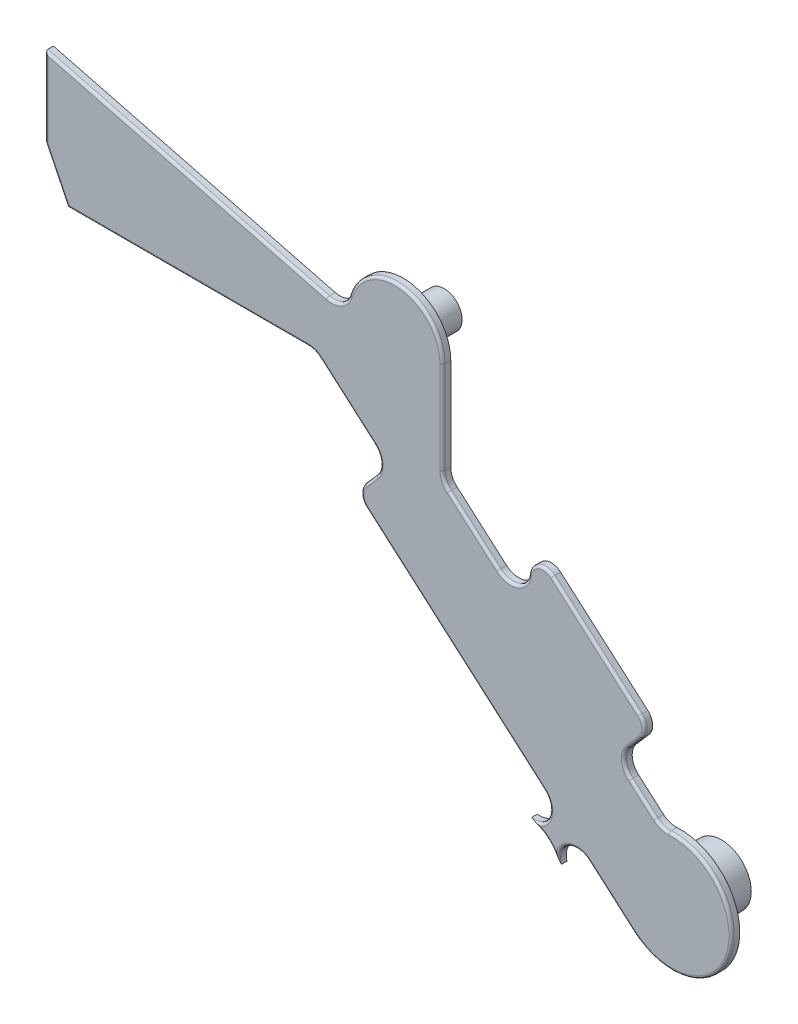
SolidWorks part; units mm, degrees
ref_plane "Front" through (0, 0, 0) normal (0, 0, 1) x (1, 0, 0)
ref_plane "Top" through (0, 0, 0) normal (0, 1, 0) x (1, 0, 0)
ref_plane "Right" through (0, 0, 0) normal (1, 0, 0) x (0, 0, -1)
sketch "Sketch1" plane through (0, 0, 0) normal (0, 0, 1) x (1, 0, 0)
  line L0 (21.628, -32.9834) -> (68.2018, -32.9834) construction
  line L1 (70.565, -33.8706) -> (81.0526, -43.0369) construction
  line L2 (81.3932, -48.1039) -> (79.2284, -50.5807) construction
  line L3 (79.4901, -54.4737) -> (113.9141, -84.5608) construction
  line L5 (135.4997, -78.6592) -> (130.6545, -74.4244) construction
  line L6 (130.3138, -69.3574) -> (132.7081, -66.618) construction
  line L7 (132.4464, -62.7249) -> (115.5735, -47.9777) construction
  line L8 (105.0817, -52.0734) -> (95.512, -43.7094) construction
  line L9 (94.2842, -41.0055) -> (94.2842, -23.1128) construction
  line L10 (71.896, -22.8886) -> (17.3176, -8.8418) construction
  line L11 (21.628, -32.9834) -> (68.2018, -32.9834)
  line L12 (70.565, -33.8706) -> (81.0526, -43.0369)
  line L13 (81.3932, -48.1039) -> (79.2284, -50.5807)
  line L14 (79.4901, -54.4737) -> (113.9141, -84.5608)
  line L15 (122.61, -92.1612) -> (131.2013, -99.6701)
  line L16 (135.4997, -78.6592) -> (130.6545, -74.4244)
  line L17 (130.3138, -69.3574) -> (132.7081, -66.618)
  line L18 (132.4464, -62.7249) -> (115.5735, -47.9777)
  line L19 (105.0817, -52.0734) -> (95.512, -43.7094)
  line L20 (94.2842, -41.0055) -> (94.2842, -23.1128)
  line L21 (71.896, -22.8886) -> (17.3176, -8.8418)
  line L22 (17.3176, -24.1697) -> (17.3176, -8.8418) construction
  line L23 (17.3176, -24.1697) -> (17.3176, -8.8418)
  line L24 (21.628, -32.9834) -> (17.3176, -24.1697)
  arc A0 (70.565, -33.8706) -> (68.2018, -32.9834) centre (68.2018, -36.5744) ccw construction
  arc A1 (81.3932, -48.1039) -> (81.0526, -43.0369) centre (78.6894, -45.7407) ccw construction
  arc A2 (79.2284, -50.5807) -> (79.4901, -54.4737) centre (81.3058, -52.3964) ccw construction
  arc A6 (131.2013, -99.6701) -> (138.0779, -79.54) centre (138.7662, -91.0147) ccw construction
  arc A7 (135.4997, -78.6592) -> (138.0779, -79.54) centre (137.8629, -75.9554) ccw construction
  arc A8 (130.3138, -69.3574) -> (130.6545, -74.4244) centre (133.0176, -71.7206) ccw construction
  arc A9 (132.7081, -66.618) -> (132.4464, -62.7249) centre (130.6307, -64.8023) ccw construction
  arc A10 (115.5735, -47.9777) -> (111.0149, -49.7573) centre (113.7578, -50.0551) ccw construction
  arc A11 (105.0817, -52.0734) -> (111.0149, -49.7573) centre (107.4449, -49.3696) ccw construction
  arc A12 (94.2842, -41.0055) -> (95.512, -43.7094) centre (97.8752, -41.0055) ccw construction
  arc A13 (94.2842, -23.1128) -> (76.2289, -20.4482) centre (85.0599, -23.1128) ccw construction
  arc A14 (71.896, -22.8886) -> (76.2289, -20.4482) centre (72.791, -19.4109) ccw construction
  arc A15 (70.565, -33.8706) -> (68.2018, -32.9834) centre (68.2018, -36.5744) ccw
  arc A16 (81.3932, -48.1039) -> (81.0526, -43.0369) centre (78.6894, -45.7407) ccw
  arc A17 (79.2284, -50.5807) -> (79.4901, -54.4737) centre (81.3058, -52.3964) ccw
  arc A18 (116.7891, -95.8343) -> (111.0532, -90.821) centre (110.0887, -97.7125) ccw
  arc A19 (111.0532, -90.821) -> (116.7891, -95.8343) centre (110.0887, -97.7125) ccw construction
  arc A20 (111.0532, -90.821) -> (113.9141, -84.5608) centre (111.5509, -87.2646) ccw construction
  arc A21 (131.2013, -99.6701) -> (138.0779, -79.54) centre (138.7662, -91.0147) ccw
  arc A22 (135.4997, -78.6592) -> (138.0779, -79.54) centre (137.8629, -75.9554) ccw
  arc A23 (130.3138, -69.3574) -> (130.6545, -74.4244) centre (133.0176, -71.7206) ccw
  arc A24 (132.7081, -66.618) -> (132.4464, -62.7249) centre (130.6307, -64.8023) ccw
  arc A25 (115.5735, -47.9777) -> (111.0149, -49.7573) centre (113.7578, -50.0551) ccw
  arc A26 (105.0817, -52.0734) -> (111.0149, -49.7573) centre (107.4449, -49.3696) ccw
  arc A27 (94.2842, -41.0055) -> (95.512, -43.7094) centre (97.8752, -41.0055) ccw
  arc A28 (94.2842, -23.1128) -> (76.2289, -20.4482) centre (85.0599, -23.1128) ccw
  arc A29 (71.896, -22.8886) -> (76.2289, -20.4482) centre (72.791, -19.4109) ccw
  arc A30 (122.61, -92.1612) -> (116.7891, -95.8343) centre (120.2468, -94.865) ccw construction
  arc A31 (111.0532, -90.821) -> (113.9141, -84.5608) centre (111.5509, -87.2646) ccw
  arc A32 (122.61, -92.1612) -> (116.7891, -95.8343) centre (120.2468, -94.865) ccw
extrude "Extrude1" add sketch "Sketch1" along normal blind 1.5875
sketch "Sketch2" plane through (0, 0, 0) normal (0, 0, -1) x (-1, 0, 0)
  circle A2 centre (-138.7662, -91.0147) radius 5.7853 construction
  circle A3 centre (-138.7662, -91.0147) radius 5.7853
  circle A4 centre (-85.0599, -23.1128) radius 3.4925 construction
  circle A5 centre (-85.0599, -23.1128) radius 3.4925
extrude "Extrude2" add sketch "Sketch2" along normal up to vertex (9.525 mm away)
fillet "Fillet1" radius 0.508 28 edges at (17.3176, -16.5058, 1.5875) (44.6068, -15.8652, 1.5875) (74.5532, -22.5398, 1.5875) (86.4067, -13.9874, 1.5875) (94.2842, -32.0592, 1.5875) (94.6055, -42.4903, 1.5875) (100.2969, -47.8914, 1.5875) (108.7508, -52.7147, 1.5875) (112.7545, -47.485, 1.5875) (124.0099, -55.3513, 1.5875) (133.3835, -64.6173, 1.5875) (131.511, -67.9877, 1.5875) (129.4347, -71.9615, 1.5875) (133.0771, -76.5418, 1.5875) (136.702, -79.3536, 1.5875) (149.6444, -94.7308, 1.5875) (126.9057, -95.9157, 1.5875) (118.3305, -91.8281, 1.5875) (114.6681, -92.473, 1.5875) (114.817, -88.7572, 1.5875) (96.7021, -69.5173, 1.5875) (78.553, -52.5814, 1.5875) (80.3108, -49.3423, 1.5875) (82.2723, -45.4998, 1.5875) (75.8088, -38.4537, 1.5875) (69.4639, -33.2125, 1.5875) (44.9149, -32.9834, 1.5875) (19.4728, -28.5766, 1.5875)
